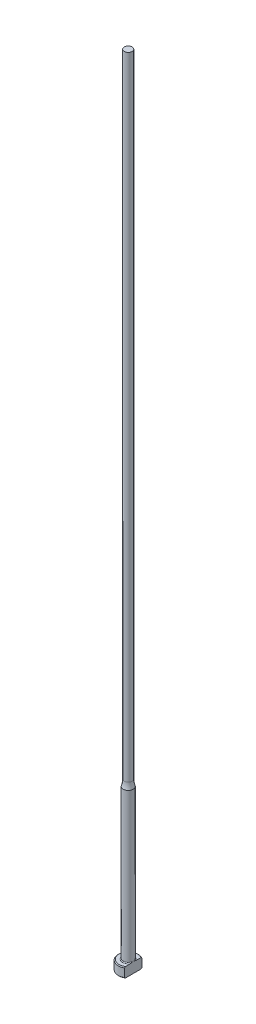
SolidWorks part; units mm, degrees
ref_plane "Front Plane" through (0, 0, 0) normal (0, 0, 1) x (1, 0, 0)
ref_plane "Top Plane" through (0, 0, 0) normal (0, 1, 0) x (1, 0, 0)
ref_plane "Right Plane" through (0, 0, 0) normal (1, 0, 0) x (0, 0, -1)
sketch "Sketch1" plane through (0, 0, 0) normal (0, 0, 1) x (1, 0, 0)
  line L0 (0, 259.9588) -> (0, -15.1925) construction
  line L1 (0, 0) -> (-3.175, 0)
  line L2 (-3.175, 0) -> (-3.175, 3.175)
  line L3 (-3.175, 3.175) -> (-1.5875, 3.175)
  line L4 (-1.2535, 52.8323) -> (-1.2535, 254)
  line L5 (-1.2535, 254) -> (0, 254)
  line L6 (0, 254) -> (0, 0)
  line L7 (-1.5875, 3.175) -> (-1.5875, 50.8)
  arc A0 (-1.5875, 50.8) -> (-1.2535, 52.8323) centre (-7.6035, 52.8323) ccw
  point P13 (-1.5875, 0)
  dimension "D1" = 6.35
  dimension "L" = 254
  dimension "D2" = 3.175
  dimension "H" = 6.35
  dimension "T" = 3.175
  dimension "D" = 2.507
  dimension "S" = 50.8
revolve "Revolve1" add sketch "Sketch1" angle 360 about L0
chamfer "Chamfer1" distance 0.254 angle 45 2 edges at (0, 3.175, 3.175) (0, 0, 3.175)
fillet "Fillet1" radius 0.254 1 edges at (0, 3.175, 1.5875)
sketch "Sketch2" plane through (0, 0, 0) normal (0, 1, 0) x (1, 0, 0)
  line L0 (1.5875, -2.7496) -> (1.5875, 2.7496)
  circle A0 centre (0, 0) radius 3.175 construction
  arc A2 (1.5875, -2.7496) -> (1.5875, 2.7496) centre (0, 0) ccw
  circle A3 centre (0, 0) radius 3.175 construction
  circle A4 centre (0, 0) radius 1.5875 construction
extrude "Key Head" cut sketch "Sketch2" along normal up to next
